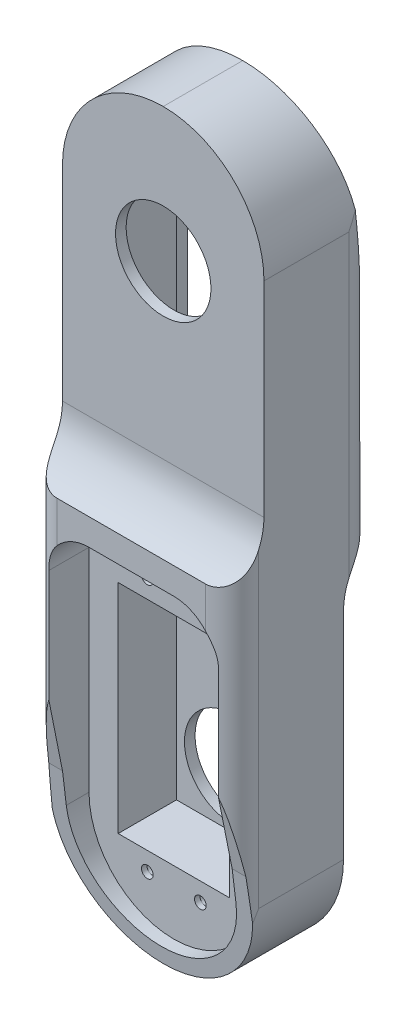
SolidWorks part; units mm, degrees
ref_plane "Front Plane" through (0, 0, 0) normal (0, 0, 1) x (1, 0, 0)
ref_plane "Top Plane" through (0, 0, 0) normal (0, 1, 0) x (1, 0, 0)
ref_plane "Right Plane" through (0, 0, 0) normal (1, 0, 0) x (0, 0, -1)
sketch "Sketch1" plane through (0, 0, 0) normal (0, 0, 1) x (1, 0, 0)
  line L5 (-19, -60) -> (19, -60)
  line L6 (-19, -60) -> (-19, 60)
  line L7 (-19, 60) -> (19, 60)
  line L8 (19, -60) -> (19, 60)
  line L9 (-19, -60) -> (19, 60) construction
  line L10 (-19, 60) -> (19, -60) construction
  line L11 (-10.5, -45) -> (10.5, -45)
  line L12 (-10.5, -45) -> (-10.5, -4)
  line L13 (-10.5, -4) -> (10.5, -4)
  line L14 (10.5, -45) -> (10.5, -4)
  line L15 (-10.5, -45) -> (10.5, -4) construction
  line L16 (-10.5, -4) -> (10.5, -45) construction
  point P0 (0, 0)
  point P6 (0, -24.5)
  dimension "D1" = 21
  dimension "D2" = 41
  dimension "D3" = 8.5
  dimension "D4" = 120
  dimension "D5" = 15
extrude "Boss-Extrude1" add sketch "Sketch1" along normal blind 11
ref_plane "Plane1" through (0, 0, 10) normal (0, 0, 1) x (1, 0, 0)
sketch "Sketch3" plane through (0, 0, 10) normal (0, 0, 1) x (1, 0, 0)
  line L0 (10.5, -4) -> (-10.5, -4) construction
  circle A0 centre (-5, -0.5) radius 1.3
  circle A1 centre (5, -0.5) radius 1.3
  circle A2 centre (5, -48.5) radius 1.3
  circle A3 centre (-5, -48.5) radius 1.3
  dimension "D1" = 2.6
  dimension "D2" = 5
  dimension "D3" = 3.5
  dimension "D4" = 2
  dimension "D5" = 2
extrude "Cut-Extrude1" cut sketch "Sketch3" against normal blind 8
fillet "Fillet3" radius 19 2 edges at (19, -60, 5.5) (-19, -60, 5.5)
sketch "Sketch4" plane through (0, 0, 11) normal (0, 0, 1) x (1, 0, 0)
  line L0 (16, -41) -> (16, 57)
  line L1 (16, 57) -> (-16, 57)
  line L2 (-16, 57) -> (-16, -41)
  line L3 (19, -41) -> (19, 60)
  line L4 (19, 60) -> (-19, 60)
  line L5 (-19, 60) -> (-19, -41)
  line L6 (19, -41) -> (19, 60)
  line L7 (19, 60) -> (-19, 60)
  line L8 (-19, 60) -> (-19, -41)
  arc A0 (-16, -41) -> (0, -57) centre (0, -41) ccw
  arc A1 (0, -57) -> (16, -41) centre (0, -41) ccw
  arc A2 (-19, -41) -> (0, -60) centre (0, -41) ccw
  arc A3 (0, -60) -> (19, -41) centre (0, -41) ccw
  arc A4 (-19, -41) -> (0, -60) centre (0, -41) ccw
  arc A5 (0, -60) -> (19, -41) centre (0, -41) ccw
  dimension "D1" = 0
  dimension "D2" = 3
extrude "Boss-Extrude2" add sketch "Sketch4" along normal blind 8
sketch "Sketch6" plane through (0, 0, 0) normal (1, 0, 0) x (0, 0, -1)
  line L7 (-13, -60) -> (-16, -35)
  line L8 (-16, -35) -> (-19, -20)
  line L9 (-19, -41) -> (-19, 60) construction
  line L10 (-19, -20) -> (-19, -60)
  line L11 (-19, -41) -> (-19, -60) construction
  line L12 (-19, -60) -> (-13, -60)
  line L13 (-11, -60) -> (0, -60) construction
  dimension "D1" = 6
  dimension "D2" = 25
  dimension "D3" = 15
  dimension "D4" = 3
extrude "Cut-Extrude2" cut sketch "Sketch6" against normal through all both and the other way through all
sketch "Sketch7" plane through (0, 0, 11) normal (0, 0, 1) x (1, 0, 0)
  line L0 (16, -20) -> (16, 57) construction
  line L1 (16, 7) -> (-16, 7)
  line L2 (16, 7) -> (16, 57)
  line L3 (16, 57) -> (-16, 57)
  line L4 (-16, 7) -> (-16, 57)
  dimension "D1" = 50
extrude "Boss-Extrude4" add sketch "Sketch7" along normal up to surface (8 mm away)
sketch "Sketch8" plane through (0, 0, 0) normal (0, 0, -1) x (-1, 0, 0)
  line L0 (-19, 60) -> (19, 60)
  line L1 (19, 60) -> (19, -3.3108)
  line L2 (19, 60) -> (19, -41) construction
  line L3 (-19, 60) -> (-19, -4)
  line L4 (-19, -41) -> (-19, 60) construction
  line L7 (19, 10) -> (-19, 10)
  arc A0 (19, -3.3108) -> (-19, -4) centre (0.25, -17.4388) ccw
  dimension "D1" = 23.4769
  dimension "D2" = 64
  dimension "D3" = 19.25
  dimension "D4" = 50
extrude "Boss-Extrude5" add sketch "Sketch8" along normal blind 8 contours L7 L1 M6 M2
sketch "Sketch27" plane through (0, 0, 0) normal (0, 0, -1) x (-1, 0, 0)
  line L0 (10.5, -45) -> (-10.5, -45) construction
  line L3 (19, -41) -> (19, 10)
  line L4 (19, 10) -> (-19, 10)
  line L5 (-19, 10) -> (-19, -41)
  line L6 (19, -41) -> (19, 10)
  line L7 (19, 10) -> (-19, 10)
  line L8 (-19, 10) -> (-19, -41)
  circle A0 centre (0, -34.75) radius 9
  arc A2 (-19, -41) -> (0, -60) centre (0, -41) ccw
  arc A3 (0, -60) -> (19, -41) centre (0, -41) ccw
  arc A4 (-19, -41) -> (0, -60) centre (0, -41) ccw
  arc A5 (0, -60) -> (19, -41) centre (0, -41) ccw
  dimension "D2" = 18
  dimension "D3" = 10.25
  dimension "D1" = 0
extrude "Boss-Extrude10" add sketch "Sketch27" along normal blind 2
sketch "Sketch28" plane through (0, 60, 0) normal (0, 1, 0) x (1, 0, 0)
  line L4 (19, -19) -> (19, 8)
  line L5 (19, 8) -> (-19, 8)
  line L6 (-19, 8) -> (-19, -19)
  line L7 (-19, -19) -> (19, -19)
  line L8 (19, -19) -> (19, 8)
  line L9 (19, 8) -> (-19, 8)
  line L10 (-19, 8) -> (-19, -19)
  line L11 (-19, -19) -> (19, -19)
  dimension "D1" = 0
extrude "Boss-Extrude11" add sketch "Sketch28" along normal blind 20
fillet "Fillet4" radius 19 2 edges at (-19, 80, 5.5) (19, 80, 5.5)
sketch "Sketch29" plane through (0, 0, -8) normal (0, 0, -1) x (-1, 0, 0)
  line L6 (16, 13) -> (16, 61)
  line L7 (-16, 61) -> (-16, 13)
  line L8 (-16, 13) -> (16, 13)
  line L9 (16, 13) -> (16, 61)
  line L10 (-16, 61) -> (-16, 13)
  line L11 (-16, 13) -> (16, 13)
  arc A4 (16, 61) -> (0, 77) centre (0, 61) ccw
  arc A5 (0, 77) -> (-16, 61) centre (0, 61) ccw
  arc A6 (16, 61) -> (0, 77) centre (0, 61) ccw
  arc A7 (0, 77) -> (-16, 61) centre (0, 61) ccw
  dimension "D1" = 3
extrude "Cut-Extrude14" cut sketch "Sketch29" against normal blind 8
sketch "Sketch30" plane through (0, 0, 0) normal (0, 0, -1) x (-1, 0, 0)
  line L0 (-16, 13) -> (16, 13) construction
  line L1 (-10.5, 24) -> (10.5, 24)
  line L2 (-10.5, 24) -> (-10.5, 65)
  line L3 (-10.5, 65) -> (10.5, 65)
  line L4 (10.5, 24) -> (10.5, 65)
  line L5 (-10.5, 24) -> (10.5, 65) construction
  line L6 (-10.5, 65) -> (10.5, 24) construction
  line L7 (-16, 61) -> (-16, 13) construction
  point P0 (0, 44.5)
  dimension "D1" = 21
  dimension "D2" = 11
  dimension "D3" = 5.5
  dimension "D4" = 41
extrude "Cut-Extrude15" cut sketch "Sketch30" against normal blind 11 contours L4 L3 L2 L1
sketch "Sketch31" plane through (0, 0, 11) normal (0, 0, -1) x (-1, 0, 0)
  line L0 (-10.5, 65) -> (10.5, 65) construction
  circle A0 centre (0, 54.75) radius 9
  dimension "D1" = 18
  dimension "D2" = 10.25
extrude "Cut-Extrude16" cut sketch "Sketch31" against normal up to next
sketch "Sketch32" plane through (0, 0, 19) normal (0, 0, 1) x (1, 0, 0)
  line L0 (-19, 12) -> (19, 12)
  line L7 (-19, 61) -> (-19, -20)
  line L8 (-19, -20) -> (-16, -20)
  line L9 (-16, -20) -> (-16, 7)
  line L10 (-16, 7) -> (16, 7)
  line L11 (16, 7) -> (16, -20)
  line L12 (16, -20) -> (19, -20)
  line L13 (19, -20) -> (19, 61)
  line L14 (-19, 61) -> (-19, -20)
  line L15 (-19, -20) -> (-16, -20)
  line L16 (-16, -20) -> (-16, 7)
  line L17 (-16, 7) -> (16, 7)
  line L18 (16, 7) -> (16, -20)
  line L19 (16, -20) -> (19, -20)
  line L20 (19, -20) -> (19, 61)
  arc A2 (19, 61) -> (0, 80) centre (0, 61) ccw
  arc A3 (0, 80) -> (-19, 61) centre (0, 61) ccw
  arc A4 (19, 61) -> (0, 80) centre (0, 61) ccw
  arc A5 (0, 80) -> (-19, 61) centre (0, 61) ccw
  dimension "D2" = 5
  dimension "D1" = 0
extrude "Cut-Extrude17" cut sketch "Sketch32" against normal blind 6 and the other way through all contours L0 M14 M20 M12 M13 M11
fillet "Fillet5" radius 12 2 edges at (0, 10, -2) (0, 12, 13)
sketch "Sketch33" plane through (19, 0, 0) normal (1, 0, 0) x (0, 0, -1)
  line L0 (2, 80) -> (8, 40)
  line L1 (-13, 80) -> (8, 80) construction
  line L2 (8, 61) -> (8, 10) construction
  line L3 (2, 80) -> (8, 80)
  line L4 (8, 80) -> (8, 40)
  dimension "D1" = 6
  dimension "D2" = 40
extrude "Cut-Extrude18" cut sketch "Sketch33" against normal through all
fillet "Fillet6" [suppressed] radius 3
fillet "Fillet7" radius 5 4 edges at (-19, 25, -8) (19, 25, -8) (-19, -4, 19) (19, -4, 19)
sketch "Sketch34" plane through (0, 0, 0) normal (0, 0, -1) x (-1, 0, 0)
  line L0 (-10.5, 65) -> (10.5, 65) construction
  line L1 (0, 65) -> (0, 72.7385) construction
  circle A0 centre (-5, 68.5) radius 1.1
  circle A1 centre (5, 68.5) radius 1.1
  circle A2 centre (5, 20.5) radius 1.1
  circle A3 centre (-5, 20.5) radius 1.1
  dimension "D1" = 2.2
  dimension "D2" = 3.5
  dimension "D3" = 5
  dimension "D4" = 2
  dimension "D5" = 2
extrude "Cut-Extrude19" cut sketch "Sketch34" against normal blind 8
sketch "Sketch35" plane through (0, 0, 11) normal (0, 0, 1) x (1, 0, 0)
  line L0 (10.5, -4) -> (-10.5, -4) construction
  line L1 (0, 0) -> (0, -6.946) construction
  circle A0 centre (-5, -0.5) radius 1.1
  circle A1 centre (5, -0.5) radius 1.1
  circle A2 centre (5, -48.5) radius 1.1
  circle A3 centre (-5, -48.5) radius 1.1
  dimension "D1" = 2.2
  dimension "D2" = 5
  dimension "D3" = 3.5
  dimension "D4" = 2
  dimension "D5" = 2
extrude "Cut-Extrude20" cut sketch "Sketch35" against normal blind 8
fillet "Fillet8" radius 8 4 edges at (-16, 7, 14.7913) (16, 7, 14.7913) (16, 13, -3.7913) (-16, 13, -3.7913)
